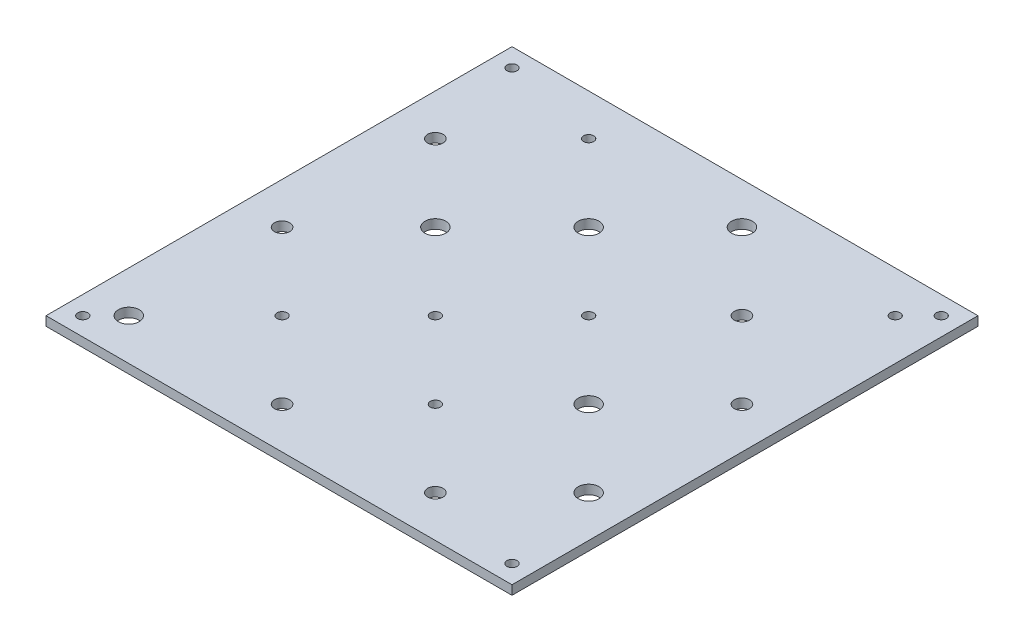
SolidWorks part; units mm, degrees
ref_plane "Front Plane" through (0, 0, 0) normal (0, 0, 1) x (1, 0, 0)
ref_plane "Top Plane" through (0, 0, 0) normal (0, 1, 0) x (1, 0, 0)
ref_plane "Right Plane" through (0, 0, 0) normal (1, 0, 0) x (0, 0, -1)
sketch "Sketch2" plane through (0, 0, 0) normal (0, 1, 0) x (1, 0, 0)
  line L1 (-76, -76) -> (76, -76)
  line L2 (-76, -76) -> (-76, 76)
  line L3 (-76, 76) -> (76, 76)
  line L4 (76, -76) -> (76, 76)
  line L5 (-76, -76) -> (76, 76) construction
  line L6 (-76, 76) -> (76, -76) construction
  point P0 (0, 0)
  dimension "D1" = 152
  dimension "D2" = 152
extrude "Boss-Extrude2" add sketch "Sketch2" along normal blind 3
hole_wizard "Tap Drill for M4x0.7 Tap1" positions "Sketch3" profile "Sketch4" hole size "M4x0.7" standard "ANSI Metric"
sketch "Sketch3" plane through (0, 3, 0) normal (0, 1, 0) x (1, 0, 0)
  line L2 (-76, 76) -> (76, -76) construction
  line L4 (76, 76) -> (-76, -76) construction
  line L6 (0, -1.65) -> (0, 1.65) construction
  line L7 (-1.65, 0) -> (1.65, 0) construction
  point P0 (-37.5, 62.5)
  point P2 (62.5, 62.5)
  point P4 (12.5, 12.5)
  point P6 (-37.5, -37.5)
  point P8 (-12.5, -12.5)
  point P10 (12.5, -37.5)
  dimension "D2" = 62.5
  dimension "D3" = 12.5
  dimension "D4" = 12.5
  dimension "D5" = 37.5
  dimension "D6" = 12.5
  dimension "D7" = 12.5
  dimension "D8" = 37.5
  dimension "D9" = 12.5
  dimension "D10" = 37.5
  dimension "D11" = 37.5
  dimension "D12" = 62.5
  dimension "D13" = 62.5
sketch "Sketch4" plane through (-37.5, 3, -62.5) normal (1, 0, 0) x (0, 0, 1)
  line L0 (0, 0) -> (0, 3)
  line L1 (0, 3) -> (1.65, 3)
  line L2 (1.65, 3) -> (1.65, 0)
  line L5 (1.65, 0) -> (0, 0)
  line L11 (0, -6.35) -> (0, 107.95) construction
  dimension "Thru Hole Dia." = 3.3
  dimension "Thru Hole Depth" = 3
hole_wizard "Tap Drill for M6x1.0 Tap1" positions "Sketch5" profile "Sketch6" hole size "M6x1.0" standard "ANSI Metric"
sketch "Sketch5" plane through (0, 3, 0) normal (0, 1, 0) x (1, 0, 0)
  line L2 (-76, 76) -> (76, -76) construction
  line L4 (76, 76) -> (-76, -76) construction
  point P0 (37.5, 37.5)
  point P2 (-62.5, 37.5)
  point P4 (62.5, 12.5)
  point P6 (37.5, -62.5)
  point P8 (-12.5, -62.5)
  point P10 (-62.5, -12.5)
  point P27 (176.1878, 220.1777)
  dimension "D1" = 37.5
  dimension "D2" = 37.5
  dimension "D3" = 12.5
  dimension "D4" = 62.5
  dimension "D5" = 62.5
  dimension "D6" = 37.5
  dimension "D7" = 62.5
  dimension "D8" = 12.5
  dimension "D9" = 62.5
  dimension "D10" = 12.5
  dimension "D11" = 37.5
  dimension "D12" = 62.5
sketch "Sketch6" plane through (37.5, 3, -37.5) normal (1, 0, 0) x (0, 0, 1)
  line L0 (0, 0) -> (0, 3)
  line L1 (0, 3) -> (2.5, 3)
  line L2 (2.5, 3) -> (2.5, 0)
  line L5 (2.5, 0) -> (0, 0)
  line L11 (0, -6.35) -> (0, 107.95) construction
  dimension "Thru Hole Dia." = 5
  dimension "Thru Hole Depth" = 3
hole_wizard "Tap Drill for M8x1.25 Tap1" positions "Sketch7" profile "Sketch8" hole size "M8x1.25" standard "ANSI Metric"
sketch "Sketch7" plane through (0, 3, 0) normal (0, 1, 0) x (1, 0, 0)
  point P0 (62.5, -37.5)
  point P2 (37.5, -12.5)
  point P4 (-12.5, 37.5)
  point P6 (12.5, 62.5)
  point P8 (-62.5, -62.5)
  point P10 (-37.5, 12.5)
  dimension "D1" = 12.5
  dimension "D2" = 62.5
  dimension "D3" = 12.5
  dimension "D4" = 37.5
  dimension "D5" = 12.5
  dimension "D6" = 37.5
  dimension "D7" = 12.5
  dimension "D8" = 37.5
  dimension "D9" = 37.5
  dimension "D10" = 62.5
  dimension "D11" = 62.5
  dimension "D12" = 62.5
sketch "Sketch8" plane through (62.5, 3, 37.5) normal (1, 0, 0) x (0, 0, 1)
  line L0 (0, 0) -> (0, 3)
  line L1 (0, 3) -> (3.4, 3)
  line L2 (3.4, 3) -> (3.4, 0)
  line L5 (3.4, 0) -> (0, 0)
  line L11 (0, -6.35) -> (0, 107.95) construction
  dimension "Thru Hole Dia." = 6.8
  dimension "Thru Hole Depth" = 3
hole_wizard "Tap Drill for M4x0.7 Tap2" positions "Sketch9" profile "Sketch10" hole size "M4x0.7" standard "ANSI Metric"
sketch "Sketch9" plane through (0, 3, 0) normal (0, 1, 0) x (1, 0, 0)
  line L0 (-76, 76) -> (-76, -76) construction
  line L1 (76, 76) -> (-76, 76) construction
  line L2 (76, -76) -> (76, 76) construction
  line L4 (-76, -76) -> (76, -76) construction
  point P0 (-70, 70)
  point P2 (70, 70)
  point P4 (-70, -70)
  point P6 (70, -70)
  dimension "D1" = 6
  dimension "D2" = 6
  dimension "D3" = 6
  dimension "D4" = 6
  dimension "D5" = 6
  dimension "D6" = 6
  dimension "D7" = 6
  dimension "D8" = 6
sketch "Sketch10" plane through (-70, 3, -70) normal (1, 0, 0) x (0, 0, 1)
  line L0 (0, 0) -> (0, 3)
  line L1 (0, 3) -> (1.65, 3)
  line L2 (1.65, 3) -> (1.65, 0)
  line L5 (1.65, 0) -> (0, 0)
  line L11 (0, -6.35) -> (0, 107.95) construction
  dimension "Thru Hole Dia." = 3.3
  dimension "Thru Hole Depth" = 3
